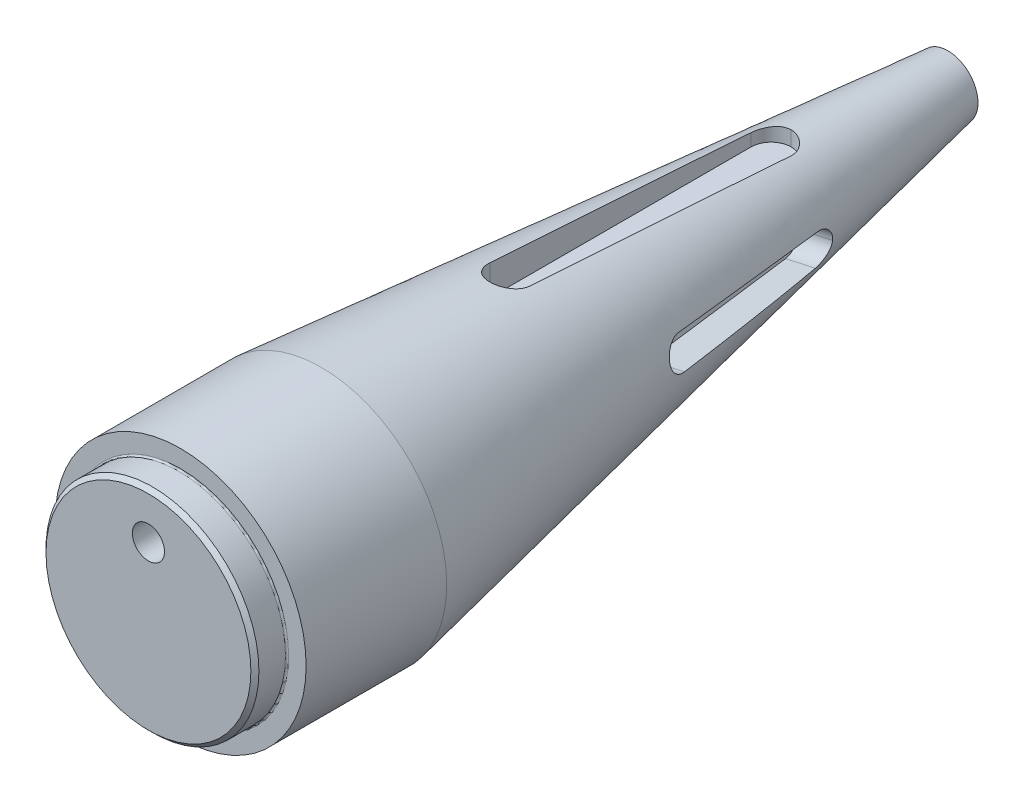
SolidWorks part; units mm, degrees
ref_plane "Plan de face" through (0, 0, 0) normal (0, 0, 1) x (1, 0, 0)
ref_plane "Plan de dessus" through (0, 0, 0) normal (0, 1, 0) x (1, 0, 0)
ref_plane "Plan de droite" through (0, 0, 0) normal (1, 0, 0) x (0, 0, -1)
ref_plane "Plan1" through (0, 0, -158) normal (0, 0, 1) x (1, 0, 0)
sketch "Esquisse1" plane through (0, 0, -158) normal (0, 0, 1) x (1, 0, 0)
  circle A0 centre (0, 0) radius 15.625
  dimension "D1" = 31.25
ref_plane "Plan2" through (0, 0, -175.5) normal (0, 0, 1) x (1, 0, 0)
ref_plane "Plan3" through (0, 0, -253.5) normal (0, 0, 1) x (1, 0, 0)
sketch "Esquisse3" plane through (0, 0, -253.5) normal (0, 0, 1) x (1, 0, 0)
  circle A0 centre (0, 7) radius 3.75
  dimension "D1" = 7.5
extrude "Boss.-Extru.2" add sketch "Esquisse1" against normal blind 17.5
sketch "Esquisse5" plane through (0, 0, -175.5) normal (0, 0, 1) x (1, 0, 0)
  circle A0 centre (0, 0) radius 15.625 construction
  circle A1 centre (0, 0) radius 15.625
loft "Lissage2" add profiles "Esquisse5", "Esquisse3"
sketch "Esquisse6" plane through (0, 0, -158) normal (0, 0, 1) x (1, 0, 0)
  circle A0 centre (0, 0) radius 13.25
  circle A1 centre (0, 0) radius 15.625 construction
  dimension "D1" = 26.5
extrude "Boss.-Extru.4" add sketch "Esquisse6" along normal blind 4 contours A0
fillet "Congé2" radius 0.2 1 edges at (13.25, 0, -158)
chamfer "Chanfrein2" distance 0.5 angle 45 1 edges at (13.25, 0, -154)
ref_plane "Plan4" through (0, 15.625, 0) normal (0, 1, 0) x (1, 0, 0)
sketch "Esquisse9" plane through (0, 15.625, 0) normal (0, 1, 0) x (1, 0, 0)
  line L0 (-2.5, 234) -> (-2.5, 196.5)
  line L1 (-2.5, 196.5) -> (2.5, 196.5)
  line L2 (2.5, 196.5) -> (2.5, 234)
  line L3 (2.5, 234) -> (-2.5, 234)
  line L4 (-15.625, 158) -> (15.625, 158) construction
  line L5 (0, -55) -> (0, 55) construction
  dimension "D1" = 5
  dimension "D2" = 38.5
  dimension "D3" = 37.5
  dimension "D4" = 2.5
extrude "Enlèv. mat.-Extru.1" cut sketch "Esquisse9" against normal blind 5.5 contours L2 L3 L0 L1
fillet "Congé3" radius 2.5 4 edges at (2.5, 12.0915, -196.5) (-2.5, 12.0915, -196.5) (-2.5, 10.8052, -234) (2.5, 10.8052, -234)
sketch "Esquisse11" plane through (0, 0, 0) normal (0, 1, 0) x (1, 0, 0)
  line L2 (0, 247.2709) -> (0, 143.7486) construction
ref_plane "Plan5" through (0, 0, 0) normal (-0.1045, 0.9945, 0) x (0, 0, 1)
sketch "Esquisse12" plane through (0, 0, 0) normal (-0.1045, 0.9945, 0) x (0, 0, 1)
  spline S0 degree 3 poles (814.8848, 153.9644) (430.5521, 102.2559) (120.9413, 57.9807) (-192.8051, 13.1521) (-200.6875, 12.0258) (-209.6251, 10.7489) (-218.379, 9.4982) (-225.9469, 8.417) (-234.085, 7.2544) (-582.0167, -42.4481) (-928.7937, -90.9447) (-1226.2337, -227.4344) knots -11.738911 -11.738911 -11.738911 -11.738911 0.134333 0.203128 0.328128 0.437504 0.546877 0.664817 0.728577 0.859878 14.046936 14.046936 14.046936 14.046936 only from (-175.5, 15.6247) to (-253.5, 4.4816) construction
  spline S1 degree 3 poles (-175.5, 15.6247) (-178.9925, 15.1257) (-184.2737, 14.3711) (-192.8051, 13.1521) (-200.6875, 12.0258) (-209.6251, 10.7489) (-218.379, 9.4982) (-225.9469, 8.417) (-234.085, 7.2544) (-242.7996, 6.0095) (-249.8568, 5.0018) (-253.5, 4.4816) knots 0 0 0 0 0.134333 0.203128 0.328128 0.437504 0.546877 0.664817 0.728577 0.859878 1 1 1 1
ref_plane "Plan6" through (39.6642, 4.1689, -5.6976) normal (-0.9845, -0.1035, 0.1414) x (0.1404, 0.0172, 0.9899)
sketch "Esquisse13" plane through (39.6642, 4.1689, -5.6976) normal (-0.9845, -0.1035, 0.1414) x (0.1404, 0.0172, 0.9899)
  line L0 (-228.8003, 6.25) -> (-228.8003, 2.25)
  line L1 (-228.8003, 2.25) -> (-204.8003, 2.25)
  line L2 (-204.8003, 2.25) -> (-204.8003, 6.25)
  line L3 (-204.8003, 6.25) -> (-228.8003, 6.25)
  line L5 (-250.3003, 9.4292) -> (-250.3003, 16.482) construction
  ellipse E0 centre (-250.8308, 7.5775) end of major axis (-250.8216, 11.3275) minor radius 0.5303 construction
  dimension "D1" = 21.5
  dimension "D3" = 4
  dimension "D4" = 24
extrude "Enlèv. mat.-Extru.3" cut sketch "Esquisse13" along normal blind 4 contours L1 L2 L3 L0
fillet "Congé4" radius 2 4 edges at (4.9184, 2.2145, -231.8601) (4.9037, 6.235, -231.928) (8.6737, 2.6684, -208.1568) (8.1023, 6.6304, -208.1447)
mirror "Symétrie1" about plane through (0, 0, 0) normal (1, 0, 0) of "Congé4", "Enlèv. mat.-Extru.3"
hole_wizard "Diamètre du perçage Ø4.5 (4.5)1" positions "Esquisse16" profile "Esquisse15" hole size "Ø4.5" standard "Ansi Metric"
sketch "Esquisse16" plane through (0, 0, -253.5) normal (0, 0, -1) x (-1, 0, 0)
  circle A0 centre (0, 7) radius 3.75 construction
  point P0 (0, 7)
sketch "Esquisse15" plane through (0, 7, -253.5) normal (1, 0, 0) x (0, 1, 0)
  line L0 (0, 0) -> (0, 7.3519)
  line L1 (0, 7.3519) -> (2.25, 6)
  line L2 (2.25, 6) -> (2.25, 0)
  line L5 (2.25, 0) -> (0, 0)
  line L10 (0, 7.3519) -> (-2.25, 6) construction
  line L11 (0, -6.35) -> (0, 107.95) construction
  dimension "Diamètre du perçage" = 4.5
  dimension "Profondeur du perçage" = 6
  dimension "Angle de pointe" = 118
hole_wizard "Diamètre du perçage Ø4.0 (4)1" positions "Esquisse18" profile "Esquisse17" hole size "Ø4.0" standard "Ansi Metric"
sketch "Esquisse18" plane through (0, 0, -154) normal (0, 0, 1) x (1, 0, 0)
  point P0 (0, 7.5)
sketch "Esquisse17" plane through (0, 7.5, -154) normal (1, 0, 0) x (0, -1, 0)
  line L0 (0, 0) -> (0, 7.2017)
  line L1 (0, 7.2017) -> (2, 6)
  line L2 (2, 6) -> (2, 0)
  line L5 (2, 0) -> (0, 0)
  line L10 (0, 7.2017) -> (-2, 6) construction
  line L11 (0, -6.35) -> (0, 107.95) construction
  dimension "Diamètre du perçage" = 4
  dimension "Profondeur du perçage" = 6
  dimension "Angle de pointe" = 118
